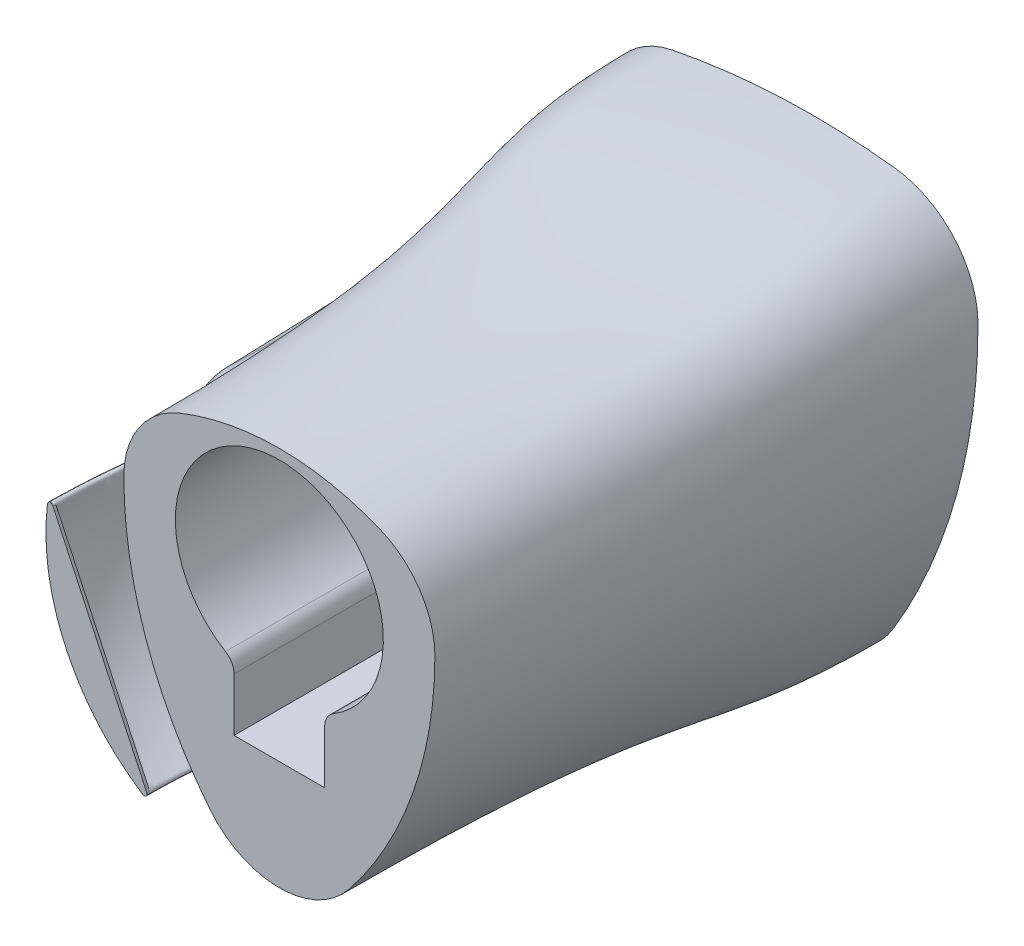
SolidWorks part; units mm, degrees
ref_plane "Front Plane" through (0, 0, 0) normal (0, 0, 1) x (1, 0, 0)
ref_plane "Top Plane" through (0, 0, 0) normal (0, 1, 0) x (1, 0, 0)
ref_plane "Right Plane" through (0, 0, 0) normal (1, 0, 0) x (0, 0, -1)
sketch "Sketch1" plane through (0, 0, 0) normal (0, 0, 1) x (1, 0, 0)
  line L0 (-29.21, 5.3764) -> (22.86, 5.3764) construction
  arc A0 (-8.4405, -40.894) -> (10.8993, -37.9234) centre (0, -31.4046) ccw construction
  arc A1 (10.8993, -37.9234) -> (22.86, 5.3764) centre (-61.4966, 5.3764) ccw construction
  arc A2 (-8.4405, -40.894) -> (-29.21, 5.3764) centre (32.7152, 5.3764) cw construction
  arc A3 (-29.21, 5.3764) -> (-19.943, 16.6823) centre (-17.6797, 5.3764) cw construction
  arc A4 (22.86, 5.3764) -> (11.6114, 17.9931) centre (10.16, 5.3764) ccw construction
  arc A5 (-19.943, 16.6823) -> (11.6114, 17.9931) centre (0, -82.9412) cw construction
  circle A6 centre (0, 0) radius 14.605 construction
  arc A7 (-29.972, 5.3764) -> (-20.0926, 17.4295) centre (-17.6797, 5.3764) cw
  arc A8 (-20.0926, 17.4295) -> (11.6985, 18.7502) centre (0, -82.9412) cw
  arc A9 (23.622, 5.3764) -> (11.6985, 18.7502) centre (10.16, 5.3764) ccw
  arc A10 (11.5533, -38.3145) -> (23.622, 5.3764) centre (-61.4966, 5.3764) ccw
  arc A11 (-8.9469, -41.4633) -> (11.5533, -38.3145) centre (0, -31.4046) ccw
  arc A12 (-8.9469, -41.4633) -> (-29.972, 5.3764) centre (32.7152, 5.3764) cw
  dimension "D1" = 101.6
  dimension "D2" = 12.7
  dimension "D6" = 12.7
  dimension "D7" = 29.21
  dimension "D3" = 29.21
  dimension "D4" = 22.86
  dimension "D5" = 51.5366
  dimension "D8" = 82.9412
  dimension "D9" = 0.762
ref_plane "End Plane" through (0, 0, 76.2) normal (0, 0, 1) x (1, 0, 0)
sketch "Sketch4" plane through (0, 0, 76.2) normal (0, 0, 1) x (1, 0, 0)
  line L0 (0, 16.1695) -> (0, -8.8103) construction
  line L1 (-22.225, 1.7278) -> (-22.225, 11.2362) construction
  arc A0 (-14.2875, 13.501) -> (14.2875, 13.501) centre (0, -21.8186) cw
  arc A1 (-14.2875, 13.501) -> (-22.225, 1.7278) centre (-9.525, 1.7278) ccw
  arc A2 (14.2875, 13.501) -> (22.225, 1.7278) centre (9.525, 1.7278) cw
  arc A3 (-22.225, 1.7278) -> (-9.9123, -33.3395) centre (33.8684, 1.7278) ccw
  arc A4 (22.225, 1.7278) -> (9.9123, -33.3395) centre (-33.8684, 1.7278) cw
  circle A6 centre (0, 0) radius 14.605 construction
  arc A7 (-9.9123, -33.3395) -> (9.9123, -33.3395) centre (0, -25.4) ccw
  point P12 (0, 16.2814)
  point P33 (0, 14.605)
  dimension "D1" = 12.7
  dimension "D3" = 38.1
  dimension "D2" = 1.6764
  dimension "D4" = 44.45
  dimension "D5" = 25.4
loft "Loft4" add profiles "Sketch1", "Sketch4"
ref_plane "Plane4" through (0, 0, 38.1) normal (0, 0, 1) x (1, 0, 0)
sketch "Sketch10" plane through (0, 0, 38.1) normal (0, 0, 1) x (1, 0, 0)
  line L0 (-19.1505, -0.8524) -> (-5.7324, -29.6276) construction
  line L1 (-17.7118, -0.1815) -> (-4.2936, -28.9567)
  line L2 (-20.5893, -1.5233) -> (-7.1712, -30.2985)
  line L3 (-14.6178, -6.8164) -> (-13.2366, -6.1723) construction
  line L4 (-29.21, 5.3764) -> (22.86, 5.3764) construction
  arc A0 (-17.7118, -0.1815) -> (-20.5893, -1.5233) centre (-19.1505, -0.8524) ccw
  arc A1 (-7.1712, -30.2985) -> (-4.2936, -28.9567) centre (-5.7324, -29.6276) ccw
  circle A2 centre (0, 0) radius 14.605 construction
  spline S0 degree 3 number of poles 140 (-15.933, 14.6146) -> (-15.933, 14.6146)
  spline S1 degree 3 number of poles 140 (-15.933, 14.6146) -> (-15.933, 14.6146) construction
  point P3 (-12.4415, -15.24)
  dimension "D1" = 31.75
  dimension "D2" = 3.175
  dimension "D3" = 1.524
  dimension "D4" = 65
  dimension "D5" = 15.24
ref_plane "Plane5" through (-12.4415, -15.24, 38.1) normal (0.4226, -0.9063, 0) x (-0.9063, -0.4226, 0)
sketch "Sketch11" plane through (-12.4415, -15.24, 38.1) normal (0.4226, -0.9063, 0) x (-0.9063, -0.4226, 0)
  circle A0 centre (19.05, 0) radius 19.05
  dimension "D1" = 38.1
ref_plane "Plane6" through (-19.8131, -9.239, 1.5287) normal (-0.9041, -0.4216, 0.0698) x (0.4226, -0.9063, 0)
ref_plane "Plane7" through (-28.9987, -13.5223, 2.2374) normal (-0.9041, -0.4216, 0.0698) x (0.4226, -0.9063, 0)
sketch "Sketch13" plane through (-28.9987, -13.5223, 2.2374) normal (-0.9041, -0.4216, 0.0698) x (0.4226, -0.9063, 0)
  line L1 (-6.0509, 60.1393) -> (23.1591, 60.1393)
  line L2 (-12.4009, 53.7893) -> (-12.4009, 15.6893)
  line L3 (-6.0509, 9.3393) -> (23.1591, 9.3393)
  line L4 (29.5091, 53.7893) -> (29.5091, 15.6893)
  line L5 (-7.3209, 36.7713) -> (24.4291, 36.7713) construction
  arc A0 (-6.0509, 9.3393) -> (-12.4009, 15.6893) centre (-6.0509, 15.6893) cw
  arc A1 (23.1591, 9.3393) -> (29.5091, 15.6893) centre (23.1591, 15.6893) ccw
  arc A2 (23.1591, 60.1393) -> (29.5091, 53.7893) centre (23.1591, 53.7893) cw
  arc A3 (-6.0509, 60.1393) -> (-12.4009, 53.7893) centre (-6.0509, 53.7893) ccw
  point P4 (-12.4009, 34.7393)
  point P13 (-12.4009, 9.3393)
  point P20 (-12.4009, 60.1393)
  dimension "D4" = 6.35
  dimension "D1" = 5.08
  dimension "D2" = 5.08
  dimension "D3" = 50.8
  dimension "D5" = 2.032
extrude "Boss-Extrude3" add sketch "Sketch13" against normal up to body draft 19 separate body
sweep "Cut-Sweep3" cut profiles "Sketch10" path "Sketch11"
fillet "Fillet17" radius 12.7 6 edges at (-11.4914, -38.2101, 13.1566) (-7.1649, -38.5839, 32.5159) (-6.2133, -36.7424, 59.7757) (-20.978, 8.1242, 58.1414) (-24.1848, 6.3349, 36.3673) (-29.0116, -1.1599, 11.5815)
fillet "Fillet21" radius 5.08 12 edges at (-15.5851, -39.7964, 17.2956) (-16.8169, -37.864, 13.0098) (-24.7932, -20.9997, 11.554) (-32.4485, -4.3882, 12.73) (-33.2771, -1.9311, 16.8405) (-32.0433, -1.2592, 36.8921) (-30.2986, -1.3431, 58.9975) (-28.4942, -4.7169, 61.9945) (-21.5815, -19.5021, 62.2303) (-14.2721, -35.2836, 61.5876) (-13.1422, -38.3077, 57.9546) (-14.3314, -39.2426, 36.8921)
fillet "Fillet20" radius 1.27 14 edges at (-18.2266, -33.7339, 19.7002) (-24.3642, -20.7997, 18.3223) (-21.9216, -19.6606, 56.8649) (-31.297, -5.4274, 21.3738) (-31.4936, -5.4391, 18.7547) (-29.1517, -4.6886, 53.6429) (-29.0161, -4.4923, 56.5877) (-24.147, -20.6984, 21.7504) (-22.1388, -19.762, 53.4367) (-15.5912, -33.2803, 56.5976) (-14.6536, -35.5375, 55.0854) (-29.402, -3.8831, 55.2438) (-14.9511, -34.6326, 56.7212) (-31.642, -4.9299, 19.905)
sketch "Sketch16" plane through (0, 0, 0) normal (0, 0, -1) x (-1, 0, 0)
  line L0 (-6.477, -14.8802) -> (-6.477, -22.479)
  line L1 (-6.477, -22.479) -> (6.477, -22.479)
  line L2 (6.477, -22.479) -> (6.477, -14.8802)
  line L3 (0, -22.479) -> (0, 0) construction
  arc A0 (7.7006, -12.7079) -> (-7.7006, -12.7079) centre (0, 0) ccw
  arc A1 (6.477, -14.8802) -> (7.7006, -12.7079) centre (9.017, -14.8802) cw
  arc A2 (-6.477, -14.8802) -> (-7.7006, -12.7079) centre (-9.017, -14.8802) ccw
  dimension "D1" = 2.54
  dimension "D2" = 14.859
  dimension "D3" = 12.954
  dimension "D4" = 37.084
extrude "Cut-Extrude3" cut sketch "Sketch16" against normal through all
sketch "Sketch17" plane through (0, 0, 0) normal (0, 0, -1) x (-1, 0, 0)
  circle A0 centre (0, 0) radius 17.526
  dimension "D1" = 35.052
extrude "Cut-Extrude4" cut sketch "Sketch17" against normal blind 12.954
sketch "Sketch18" plane through (0, 0, 0) normal (0, 0, -1) x (-1, 0, 0)
  line L0 (-17.024, -4.1646) -> (-11.1026, -28.37)
  line L1 (11.1026, -28.37) -> (17.024, -4.1646)
  arc A0 (-17.024, -4.1646) -> (17.024, -4.1646) centre (0, 0) cw
  arc A1 (-11.1026, -28.37) -> (11.1026, -28.37) centre (0, -25.654) ccw
  arc A2 (6.477, -16.2852) -> (-6.477, -16.2852) centre (0, 0) ccw construction
  point P7 (0, 17.526)
  point P12 (0, -37.084)
  dimension "D1" = 54.61
  dimension "D2" = 11.43
extrude "Cut-Extrude5" cut sketch "Sketch18" against normal blind 3.81
sketch "Sketch19" plane through (-28.9987, -13.5223, 2.2374) normal (-0.9041, -0.4216, 0.0698) x (0.0632, 0.0295, 0.9976)
  text T0 "HOFFMAN  TACTICAL  LR-308  GEN 2" font "Arial Rounded MT Bold" height 3.5
extrude "Cut-Extrude6" cut sketch "Sketch19" against normal blind 0.508
ref_plane "Plane8" through (0, 0, 52.5051) normal (0, 0, 1) x (1, 0, 0)
ref_plane "Plane9" through (0, 0, 52.7591) normal (0, 0, 1) x (1, 0, 0)
sketch "Sketch20" plane through (0, 0, 52.5051) normal (0, 0, 1) x (1, 0, 0)
  line L0 (-27.8336, -4.9013) -> (-14.4155, -33.6766) construction
  line L1 (-27.4653, -4.7296) -> (-14.0472, -33.5049)
  line L2 (-28.2019, -5.0731) -> (-14.7838, -33.8484)
  arc A0 (-27.4653, -4.7296) -> (-28.2019, -5.0731) centre (-27.8336, -4.9013) ccw
  arc A1 (-14.7838, -33.8484) -> (-14.0472, -33.5049) centre (-14.4155, -33.6766) ccw
  point P2 (-21.1245, -19.289)
  point P7 (0, 0)
  point P8 (-20.8459, -35.2739)
  dimension "D1" = 0.8128
sketch "Sketch22" plane through (0, 0, 52.7591) normal (0, 0, 1) x (1, 0, 0)
  line L2 (-14.0472, -33.5049) -> (-27.4653, -4.7296)
  line L3 (-28.2019, -5.0731) -> (-14.7838, -33.8484)
  line L4 (-14.0472, -33.5049) -> (-27.4653, -4.7296)
  line L5 (-28.2019, -5.0731) -> (-14.7838, -33.8484)
  arc A2 (-14.7838, -33.8484) -> (-14.0472, -33.5049) centre (-14.4155, -33.6766) ccw
  arc A3 (-27.4653, -4.7296) -> (-28.2019, -5.0731) centre (-27.8336, -4.9013) ccw
  arc A4 (-14.7838, -33.8484) -> (-14.0472, -33.5049) centre (-14.4155, -33.6766) ccw
  arc A5 (-27.4653, -4.7296) -> (-28.2019, -5.0731) centre (-27.8336, -4.9013) ccw
  dimension "D1" = 0
sketch "Sketch21" plane through (0, 0, 76.2) normal (0, 0, 1) x (1, 0, 0)
  line L0 (-21.1245, -19.289) -> (-29.7571, -23.3144) construction
  line L1 (-27.8336, -4.9013) -> (-14.4155, -33.6766) construction
  arc A0 (-19.5317, -36.2991) -> (-33.1312, -7.1349) centre (-2.8695, -10.7765) cw
  arc A1 (-19.0874, -35.6185) -> (-32.3242, -7.2321) centre (-2.8695, -10.7765) cw
  arc A2 (-19.5317, -36.2991) -> (-19.0874, -35.6185) centre (-19.3096, -35.9588) ccw
  arc A3 (-33.1312, -7.1349) -> (-32.3242, -7.2321) centre (-32.7277, -7.1835) cw
  dimension "D1" = 0.8128
  dimension "D3" = 30.48
  dimension "D2" = 31.75
  dimension "D4" = 9.525
loft "Loft6" add profiles "Sketch21", "Sketch22"
sketch "Sketch23" plane through (0, 0, 76.2) normal (0, 0, 1) x (1, 0, 0)
  line L0 (-32.3594, -7.0118) -> (-18.9412, -35.787)
  arc A4 (-19.5317, -36.2991) -> (-19.0874, -35.6185) centre (-19.3096, -35.9588) ccw
  arc A5 (-32.3242, -7.2321) -> (-19.0874, -35.6185) centre (-2.8695, -10.7765) ccw
  arc A6 (-32.3242, -7.2321) -> (-33.1312, -7.1349) centre (-32.7277, -7.1835) ccw
  arc A7 (-33.1312, -7.1349) -> (-19.5317, -36.2991) centre (-2.8695, -10.7765) ccw
  arc A8 (-19.5317, -36.2991) -> (-18.9412, -35.787) centre (-19.3096, -35.9588) ccw
  arc A10 (-32.3594, -7.0118) -> (-33.1312, -7.1349) centre (-32.7277, -7.1835) ccw
  arc A11 (-33.1312, -7.1349) -> (-19.5317, -36.2991) centre (-2.8695, -10.7765) ccw
  dimension "D1" = 0
extrude "Boss-Extrude4" add sketch "Sketch23" against normal blind 0.4064
